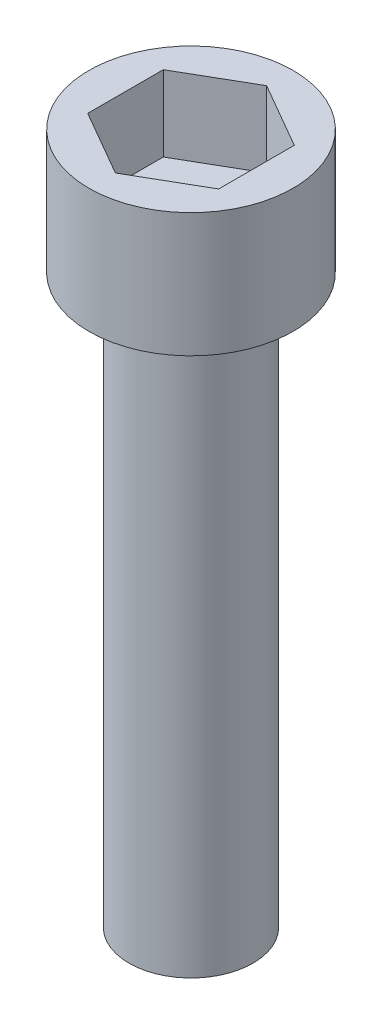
SolidWorks part; units mm, degrees
ref_plane "Front" through (0, 0, 0) normal (0, 0, 1) x (1, 0, 0)
ref_plane "Top" through (0, 0, 0) normal (0, 1, 0) x (1, 0, 0)
ref_plane "Right" through (0, 0, 0) normal (1, 0, 0) x (0, 0, -1)
sketch "Sketch1" plane through (0, 0, 0) normal (0, 0, 1) x (1, 0, 0)
  line L0 (0, 66.04) -> (0, -99.06) construction
  line L1 (0, 0) -> (-3.429, 0)
  line L2 (-3.429, 0) -> (-3.429, -4.1656)
  line L3 (-3.429, -4.1656) -> (-2.0828, -4.1656)
  line L4 (-2.0828, -4.1656) -> (-2.0828, -23.2156)
  line L5 (-2.0828, -23.2156) -> (0, -23.2156)
  line L6 (0, 0) -> (0, -23.2156)
  dimension "D1" = 6.858
  dimension "D2" = 4.1656
  dimension "D3" = 4.1656
  dimension "D4" = 19.05
revolve "Revolve1" add sketch "Sketch1" angle 360 about L0
sketch "Sketch2" plane through (0, 0, 0) normal (0, 1, 0) x (-1, 0, 0)
  line L0 (-10.16, 0) -> (12.7, 0) construction
  line L1 (0, -12.7) -> (0, 12.7) construction
  line L3 (0, -2.54) -> (2.1997, -1.27)
  line L4 (2.1997, -1.27) -> (2.1997, 1.27)
  line L5 (2.1997, 1.27) -> (0, 2.54)
  line L6 (0, 2.54) -> (-2.1997, 1.27)
  line L7 (-2.1997, 1.27) -> (-2.1997, -1.27)
  line L8 (-2.1997, -1.27) -> (0, -2.54)
  circle A0 centre (0, 0) radius 2.1997 construction
extrude "Cut-Extrude1" cut sketch "Sketch2" against normal blind 2.54
